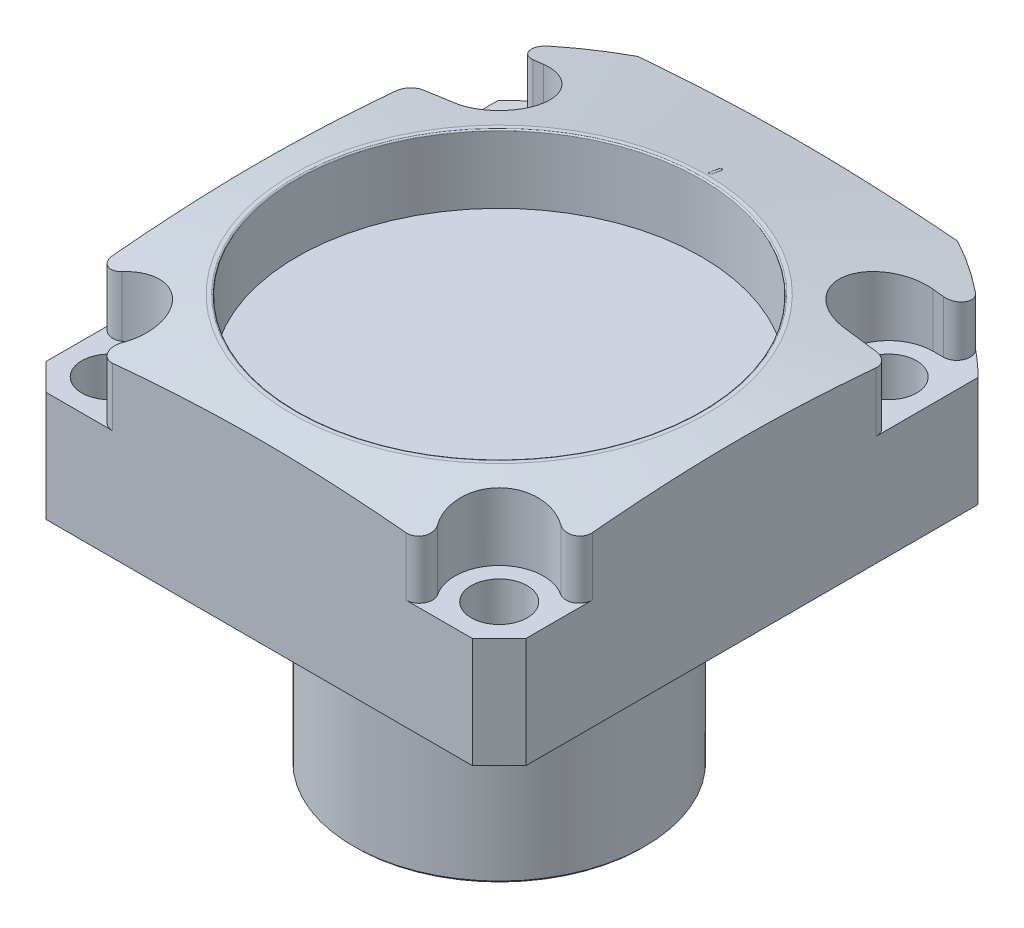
SolidWorks part; units mm, degrees
ref_plane "Front Plane" through (0, 0, 0) normal (0, 0, 1) x (1, 0, 0)
ref_plane "Top Plane" through (0, 0, 0) normal (0, 1, 0) x (1, 0, 0)
ref_plane "Right Plane" through (0, 0, 0) normal (1, 0, 0) x (0, 0, -1)
sketch "Sketch6" plane through (0, 0, 0) normal (0, 0, 1) x (1, 0, 0)
  line L0 (0, -8.9689) -> (0, 71.3762) construction
  line L1 (37.8968, 34.0614) -> (38.8747, 34.0614)
  line L2 (38.8747, 34.0614) -> (63.5, 29.7193)
  line L3 (63.5, 29.7193) -> (63.5, 0)
  line L4 (63.5, 0) -> (27.3812, 0)
  line L5 (27.3812, 0) -> (27.3812, -42.3926)
  line L6 (27.3812, -42.3926) -> (0, -42.3926)
  line L7 (0, -42.3926) -> (0, 21.2344)
  line L8 (37.8968, 34.0614) -> (37.8968, 21.2344)
  line L9 (37.8968, 21.2344) -> (0, 21.2344)
  dimension "D1" = 54.7624
  dimension "D2" = 34.0614
  dimension "D3" = 42.3926
  dimension "D4" = 127
  dimension "D5" = 10
  dimension "D6" = 77.7494
  dimension "D7" = 12.827
  dimension "D8" = 75.7936
  dimension "D9" = 76.454
revolve "Revolve3" add sketch "Sketch6" angle 360 about L0
fillet "Fillet7" radius 0.254 1 edges at (0, 34.0614, -37.8968)
sketch "Sketch7" plane through (0, 0, 0) normal (0, -1, 0) x (1, 0, 0)
  line L0 (0, 0) -> (0, -52.3237) construction
  line L1 (-39.9961, 45.0088) -> (39.9961, 45.0088)
  line L2 (-44.9961, 40.0088) -> (-44.9961, -55.9816)
  line L3 (-44.9961, -55.9816) -> (44.9961, -55.9816)
  line L4 (44.9961, 40.0088) -> (44.9961, -55.9816)
  line L5 (39.9961, 45.0088) -> (44.9961, 40.0088)
  line L6 (-44.9961, 40.0088) -> (-39.9961, 45.0088)
  point P0 (-44.9961, 45.0088)
  point P3 (44.9961, 45.0088)
  dimension "D1" = 89.9922
  dimension "D2" = 100.9904
  dimension "D3" = 45.0088
  dimension "D4" = 55.9816
  dimension "D5" = 44.9961
extrude "Cut-Extrude5" cut sketch "Sketch7" against normal through all flip side to cut
sketch "Sketch8" plane through (0, 0, 0) normal (0, -1, 0) x (1, 0, 0)
  circle A0 centre (-36.5252, 36.5252) radius 5.2451
  dimension "D1" = 10.4902
  dimension "D2" = 36.5252
  dimension "D3" = 36.5252
extrude "Cut-Extrude6" cut sketch "Sketch8" against normal through all
pattern_circular "CirPattern2" count 4 over 360 about axis through (0, 0, 0) along (0, 1, 0) of "Cut-Extrude6"
sketch "Sketch9" plane through (0, 34.0614, 0) normal (0, 1, 0) x (1, 0, 0)
  line L0 (-44.9961, -40.0088) -> (-39.9961, -45.0088) construction
  line L1 (-39.9961, -45.0088) -> (39.9961, -45.0088) construction
  line L2 (44.9961, 44.8564) -> (44.9961, 28.194)
  line L3 (-44.9961, -40.0088) -> (-39.9961, -45.0088)
  line L4 (44.9961, 28.194) -> (36.5252, 28.194)
  line L5 (36.5252, 44.8564) -> (44.9961, 44.8564)
  line L6 (-36.5252, 44.8564) -> (-44.9961, 44.8564)
  line L7 (-44.9961, 44.8063) -> (-44.9961, -40.0088) construction
  line L8 (-44.9961, 28.194) -> (-36.5252, 28.194)
  line L9 (-44.9961, 44.8564) -> (-44.9961, 28.194)
  line L10 (-39.9961, -45.0088) -> (-33.2267, -45.0088)
  line L11 (0, 0) -> (0, 26.6366) construction
  line L13 (-44.9961, -33.214) -> (-42.4162, -30.6342)
  line L14 (-30.6342, -42.4162) -> (-33.2267, -45.0088)
  line L15 (-44.9961, -33.214) -> (-44.9961, -40.0088)
  line L16 (44.9961, -33.214) -> (44.9961, -40.0088)
  line L17 (30.6342, -42.4162) -> (33.2267, -45.0088)
  line L18 (44.9961, -33.214) -> (42.4162, -30.6342)
  line L19 (39.9961, -45.0088) -> (33.2267, -45.0088)
  line L20 (44.9961, -40.0088) -> (39.9961, -45.0088)
  arc A0 (-30.6342, -42.4162) -> (-42.4162, -30.6342) centre (-36.5252, -36.5252) ccw
  arc A1 (-36.5252, 28.194) -> (-36.5252, 44.8564) centre (-36.5252, 36.5252) ccw
  arc A2 (30.6342, -42.4162) -> (42.4162, -30.6342) centre (36.5252, -36.5252) cw
  arc A3 (36.5252, 28.194) -> (36.5252, 44.8564) centre (36.5252, 36.5252) cw
  dimension "D1" = 16.6624
extrude "Cut-Extrude7" cut sketch "Sketch9" against normal offset from surface (13.4112 mm away) 20.6502
fillet "Fillet4" radius 2.4892 8 edges at (-44.9961, 26.1017, -28.194) (44.9961, 26.1017, -28.194) (44.9961, 25.8524, 33.214) (33.2267, 25.8509, 45.0088) (-33.2267, 25.8509, 45.0088) (-44.9961, 25.8524, 33.214) (44.9461, 25.1847, -44.8564) (-44.9461, 25.1847, -44.8564)
fillet "Fillet5" radius 0.4013 1 edges at (0, 0, -27.3812)
chamfer "Chamfer2" distance 0.5004 angle 45 1 edges at (0, -42.3926, -27.3812)
ref_plane "Plane1" through (0, 17.018, 0) normal (0, -1, 0) x (1, 0, 0)
sketch "Sketch11" plane through (0, 17.018, 0) normal (0, -1, 0) x (1, 0, 0)
  line L0 (-18, -4.7006) -> (-18, -58.3255) construction
  line L1 (-29.9718, -55.9816) -> (29.9718, -55.9816) construction
  line L2 (-24.1849, -55.7316) -> (-23.6396, -53.1662)
  line L3 (-23.6396, -53.1662) -> (-22.9784, -52.505)
  line L10 (-18, -55.9816) -> (-28.4775, -55.9816)
  line L11 (-18, -37.0116) -> (-18, -55.9816)
  line L12 (-22.9784, -37.0116) -> (-18, -37.0116)
  line L13 (-22.9784, -52.505) -> (-22.9784, -37.0116)
  line L15 (-28.4775, -55.7316) -> (-24.1849, -55.7316)
  line L16 (-28.4775, -55.9816) -> (-28.4775, -55.7316)
  dimension "D1" = 18
  dimension "D2" = 0.25
  dimension "D3" = 18.72
  dimension "D4" = 9.9568
  dimension "D5" = 20.955
  dimension "D6" = 12
  dimension "D7" = 12.3698
  dimension "D8" = 45
  dimension "D9" = 2.5654
revolve "Cut-Revolve5" cut sketch "Sketch11" angle 360 about L0
ref_plane "Plane2" through (0, 0, -46.7614) normal (0, 0, 1) x (1, 0, 0)
sketch "Sketch13" plane through (0, 0, -46.7614) normal (0, 0, 1) x (1, 0, 0)
  line L0 (-21.4544, 17.653) -> (-21.4544, 5.3993)
  line L1 (-22.572, 2.6416) -> (-22.1293, 4.7244)
  line L2 (-22.572, 2.6416) -> (-25.9375, 2.6416)
  line L3 (-25.9375, 2.6416) -> (-25.9375, 0)
  line L4 (-27.7825, 0) -> (27.7825, 0) construction
  line L5 (-25.9375, 0) -> (-18, 0)
  line L6 (-18, 0) -> (-18, 17.653)
  line L7 (-18, 17.653) -> (-21.4544, 17.653)
  line L8 (-18, 15.2099) -> (-18, -4.3918) construction
  line L9 (-22.1293, 4.7244) -> (-21.4544, 5.3993)
  dimension "D1" = 18
  dimension "D2" = 6.9088
  dimension "D3" = 15.0114
  dimension "D4" = 2.6416
  dimension "D5" = 15.875
  dimension "D6" = 45
  dimension "D7" = 2.0828
  dimension "D8" = 12
  dimension "D9" = 9.144
revolve "Cut-Revolve6" cut sketch "Sketch13" angle 360 about L8
mirror "Mirror4" about plane through (0, 0, 0) normal (1, 0, 0) of "Cut-Revolve5", "Cut-Revolve6"
sketch "Sketch16" plane through (0, 0, -46.7614) normal (0, 0, 1) x (1, 0, 0)
  line L0 (-22.572, 2.6416) -> (-13.428, 2.6416) construction
  line L1 (-18, 9.3219) -> (-18, -15.1063) construction
  line L2 (-18, 5.3993) -> (-18, 13.4331) construction
  line L3 (-22.572, 0.8763) -> (-22.572, -0.889) construction
  line L4 (-24.3373, -0.889) -> (-22.572, -0.889) construction
  circle A0 centre (-24.3373, 0.8763) radius 1.7653
  dimension "D1" = 3.5306
  dimension "D3" = 1.7653
  dimension "D2" = 4.572
revolve "Revolve7" add sketch "Sketch16" angle 360 about L1
mirror "Mirror3" about plane through (0, 0, 0) normal (1, 0, 0)
sketch "Sketch17" plane through (0, 0, 0) normal (1, 0, 0) x (0, 0, -1)
  line L0 (39.0485, 34.8025) -> (42.433, 34.2057) construction
  line L1 (55.9816, 31.045) -> (38.8747, 34.0614) construction
  line L2 (39.3671, 33.9746) -> (41.3367, 33.6273) construction
  line L3 (39.7451, 34.6797) -> (41.7147, 34.3324) construction
  line L5 (39.6062, 33.8918) -> (41.5758, 33.5445)
  line L6 (38.9572, 34.8186) -> (42.5025, 34.1934)
  arc A0 (38.9572, 34.8186) -> (39.6062, 33.8918) centre (39.7451, 34.6797) ccw
  arc A1 (41.5758, 33.5445) -> (42.5025, 34.1934) centre (41.7147, 34.3324) ccw
  dimension "D1" = 1.6
  dimension "D2" = 2
  dimension "D3" = 0.5
  dimension "D4" = 0.76
  dimension "D5" = 0.04
revolve "Cut-Revolve7" cut sketch "Sketch17" angle 360 about L6
equation "\"D3@Sketch16\"=\"D1@Sketch16\"/2"
